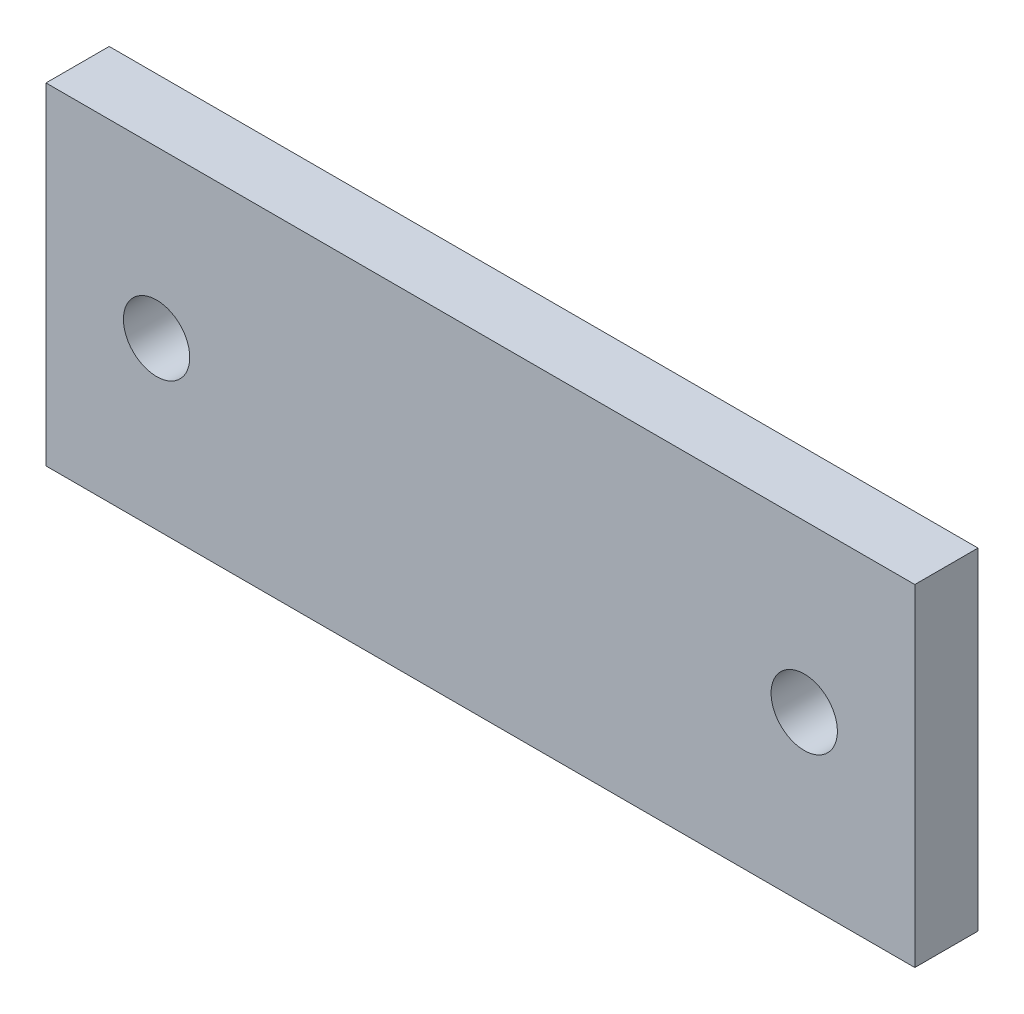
SolidWorks part; units mm, degrees
ref_plane "Plan de face" through (0, 0, 0) normal (0, 0, 1) x (1, 0, 0)
ref_plane "Plan de dessus" through (0, 0, 0) normal (0, 1, 0) x (1, 0, 0)
ref_plane "Plan de droite" through (0, 0, 0) normal (1, 0, 0) x (0, 0, -1)
sketch "Esquisse1" plane through (0, 0, 0) normal (0, 0, 1) x (1, 0, 0)
  line L1 (-27.5, 10.5) -> (27.5, 10.5)
  line L2 (-27.5, 10.5) -> (-27.5, -10.5)
  line L3 (-27.5, -10.5) -> (27.5, -10.5)
  line L4 (27.5, 10.5) -> (27.5, -10.5)
  dimension "D1" = 21
  dimension "D2" = 55
  dimension "D3" = 10.5
  dimension "D4" = 27.5
extrude "Extrusion1" add sketch "Esquisse1" along normal blind 4
hole_wizard "Trou taraudé M5x0.81" positions "Esquisse3" profile "Esquisse2" tap size "M5x0.8" standard "ISO"
sketch "Esquisse3" plane through (0, 0, 4) normal (0, 0, 1) x (1, 0, 0)
  line L0 (-27.5, 10.5) -> (-27.5, -10.5) construction
  line L1 (-27.5, -10.5) -> (27.5, -10.5) construction
  point P0 (-20.5, 0)
  point P1 (20.5, 0)
  dimension "D1" = 7
  dimension "D2" = 41
  dimension "D3" = 10.5
sketch "Esquisse2" plane through (-20.5, 0, 4) normal (1, 0, 0) x (0, -1, 0)
  line L0 (0, 0) -> (0, 4)
  line L1 (0, 4) -> (2.1, 4)
  line L2 (2.1, 4) -> (2.1, 0)
  line L5 (2.1, 0) -> (0, 0)
  line L11 (0, -6.35) -> (0, 107.95) construction
  dimension "Diamètre du trou pour taraudage jusqu'au prochain" = 4.2
  dimension "Profondeur du trou pour taraudage jusqu'au prochain" = 4
